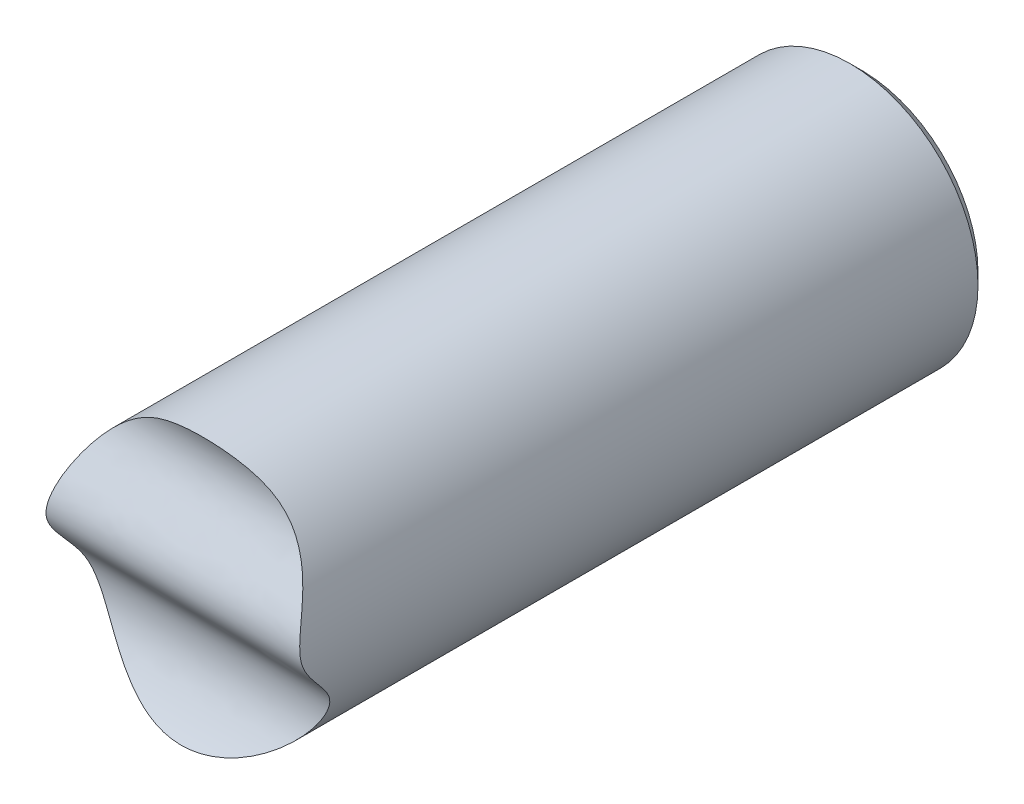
SolidWorks part; units mm, degrees
ref_plane "Plan de face" through (0, 0, 0) normal (0, 0, 1) x (1, 0, 0)
ref_plane "Plan de dessus" through (0, 0, 0) normal (0, 1, 0) x (1, 0, 0)
ref_plane "Plan de droite" through (0, 0, 0) normal (1, 0, 0) x (0, 0, -1)
sketch "Esquisse1" plane through (0, 0, 0) normal (0, 0, 1) x (1, 0, 0)
  circle A0 centre (2.1107, 0) radius 11
extrude "Extrusion1" add sketch "Esquisse1" along normal blind 60
chamfer "Chanfrein1" distance 1 angle 45 1 edges at (13.1107, 0, 0)
sketch "Esquisse2" plane through (0, 0, 0) normal (1, 0, 0) x (0, 0, -1)
  spline S0 degree 3 poles (-69.9401, -22.4343) (-66.3142, 24.0725) (-57.7041, 12.9967) (-55.484, 9.4778) (-57.5418, 5.3529) (-60.3919, 0.4777) (-55.0502, -3.1033) (-56.36, -9.4094) (-69.9401, -22.4343) (-66.3142, 24.0725) (-57.7041, 12.9967) knots -0.656408 -0.576646 -0.460159 0 0.058244 0.113086 0.188288 0.260641 0.343592 0.423354 0.539841 1 1.058244 1.113086 1.188288 only from (-60.2165, 15.7012) to (-60.2165, 15.7012)
extrude "Enlèv. mat.-Extru.1" cut sketch "Esquisse2" against normal through all and the other way through all
hole_wizard "Trou taraudé M12x1.251" positions "Esquisse4" profile "Esquisse3" tap size "M12x1.25" standard "Ansi Métrique"
sketch "Esquisse4" plane through (0, 0, 0) normal (0, 0, -1) x (-1, 0, 0)
  circle A0 centre (-2.1107, 0) radius 11 construction
  point P0 (-2.1107, 0)
sketch "Esquisse3" plane through (2.1107, 0, 0) normal (1, 0, 0) x (0, 1, 0)
  line L0 (0, 0) -> (0, 26.9946)
  line L1 (0, 26.9946) -> (5.4, 23.75)
  line L2 (5.4, 23.75) -> (5.4, 0)
  line L5 (5.4, 0) -> (0, 0)
  line L10 (0, 26.9946) -> (-5.4, 23.75) construction
  line L11 (0, -6.35) -> (0, 107.95) construction
  dimension "Diamètre du trou pour taraudage" = 10.8
  dimension "Profondeur du trou pour taraudage" = 23.75
  dimension "Angle de pointe" = 118
